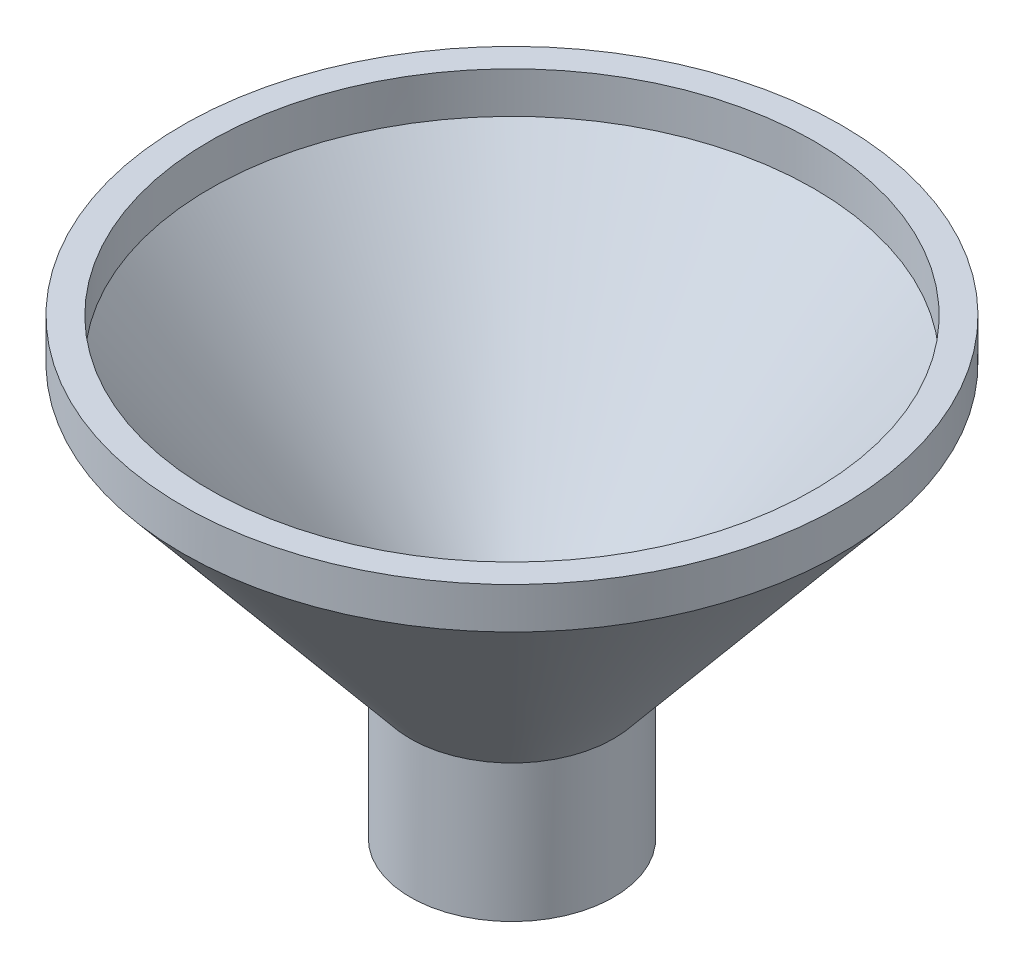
SolidWorks part; units mm, degrees
ref_plane "Front Plane" through (0, 0, 0) normal (0, 0, 1) x (1, 0, 0)
ref_plane "Top Plane" through (0, 0, 0) normal (0, 1, 0) x (1, 0, 0)
ref_plane "Right Plane" through (0, 0, 0) normal (1, 0, 0) x (0, 0, -1)
sketch "Sketch4" plane through (0, 0, 0) normal (0, 0, 1) x (1, 0, 0)
  line L0 (0, 0) -> (0, 223.1139)
  line L1 (27, 0) -> (37, 0)
  line L2 (27, 0) -> (27, 50)
  line L3 (110, 150) -> (110, 165)
  line L4 (37, 50) -> (37, 0)
  line L5 (110, 165) -> (120, 165)
  line L6 (120, 165) -> (120, 150)
  line L8 (110, 150) -> (27, 50)
  line L9 (120, 150) -> (37, 50)
revolve "Revolve-Thin1" add sketch "Sketch4" angle 360 about L0
